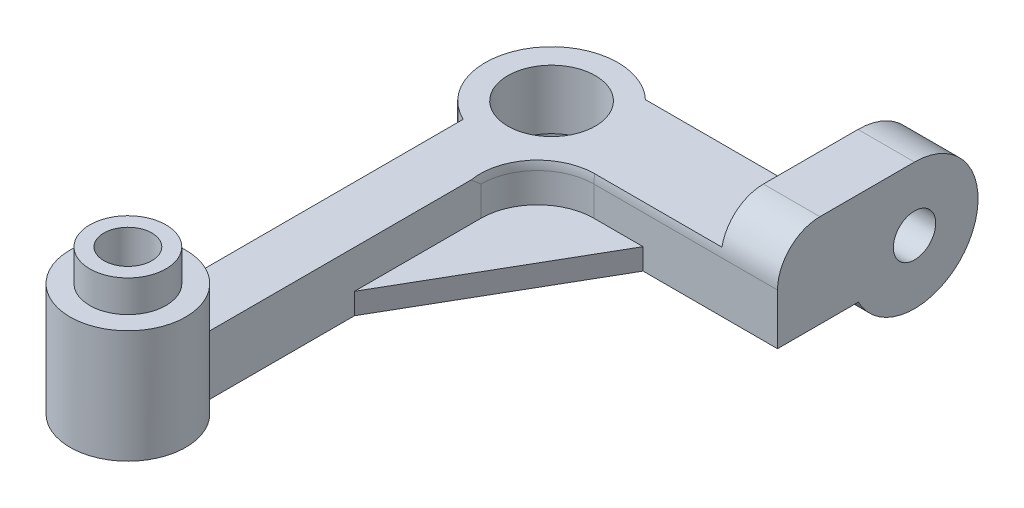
SolidWorks part; units mm, degrees
ref_plane "Plan de face" through (0, 0, 0) normal (0, 0, 1) x (1, 0, 0)
ref_plane "Plan de dessus" through (0, 0, 0) normal (0, 1, 0) x (1, 0, 0)
ref_plane "Plan de droite" through (0, 0, 0) normal (1, 0, 0) x (0, 0, -1)
sketch "Esquisse1" plane through (0, 0, 0) normal (0, 1, 0) x (1, 0, 0)
  line L0 (-13.0712, 0) -> (32.4078, 0) construction
  line L1 (0, 16.033) -> (0, -39.8697) construction
  line L2 (32.4078, 3.4) -> (-6.5829, 3.4) construction
  line L3 (40.421, -3) -> (-13.0712, -3) construction
  line L4 (-2, 23.3976) -> (-2, -39.8697) construction
  line L5 (2, 23.3976) -> (2, -39.8697) construction
  line L6 (15, 23.3976) -> (15, -6.1419) construction
  line L7 (-13.0712, -30) -> (6.0051, -30) construction
  line L8 (15, -3) -> (6, -3)
  line L9 (2, -26.4209) -> (2, -7)
  line L10 (-2, -26.4209) -> (-2, -4.2532)
  line L11 (3.245, 3.4) -> (15, 3.4)
  line L12 (15, 3.4) -> (15, -3)
  circle A0 centre (0, 0) radius 3.1
  arc A1 (2, -7) -> (6, -3) centre (6, -7) cw
  arc A2 (-2, -26.4209) -> (2, -26.4209) centre (0, -30) ccw
  circle A3 centre (0, -30) radius 1.7
  arc A5 (3.245, 3.4) -> (-2, -4.2532) centre (0, 0) ccw
  point P27 (2, -3)
  dimension "D5" = 13
  dimension "D7" = 4
  dimension "D2" = 3.4
  dimension "D1" = 3
  dimension "D3" = 2
  dimension "D4" = 4
  dimension "D6" = 30
extrude "Boss.-Extru.1" add sketch "Esquisse1" along normal blind 4.2
sketch "Esquisse2" plane through (0, 4.2, 0) normal (0, 1, 0) x (1, 0, 0)
  circle A0 centre (0, -30) radius 1.7
  circle A1 centre (0, -30) radius 4.1
extrude "Boss.-Extru.2" add sketch "Esquisse2" along normal blind 3.8
sketch "Esquisse3" plane through (0, 8, 0) normal (0, 1, 0) x (1, 0, 0)
  circle A0 centre (0, -30) radius 1.7
  circle A1 centre (0, -30) radius 2.7
extrude "Boss.-Extru.3" add sketch "Esquisse3" along normal blind 2.25
sketch "Esquisse4" plane through (0, 0, 0) normal (0, -1, 0) x (1, 0, 0)
  line L0 (-0.1464, 19.6708) -> (10.6965, 0.8904) construction
  line L1 (2, 36.0452) -> (2, 3.2) construction
  line L2 (21.2519, 3) -> (0, 3) construction
  line L3 (2, 15.9532) -> (9.4785, 3)
  line L4 (9.4785, 3) -> (2, 3)
  line L5 (2, 3) -> (2, 15.9532)
  line L8 (6, 3) -> (15, 3) construction
  dimension "D1" = 30
extrude "Boss.-Extru.4" add sketch "Esquisse4" against normal blind 1.5
sketch "Esquisse5" plane through (0, 0, 0) normal (0, -1, 0) x (1, 0, 0)
  circle A0 centre (0, 0) radius 3.2
  circle A1 centre (0, 0) radius 4.7
extrude "Boss.-Extru.5" add sketch "Esquisse5" along normal blind 3
sketch "Esquisse6" plane through (15, 0, 0) normal (1, 0, 0) x (0, 0, -1)
  line L0 (0, -4.1322) -> (0, 15.904) construction
  line L1 (10.0748, 4.2) -> (-2.3316, 4.2) construction
  line L2 (4.7, 4.2) -> (-4.2532, 4.2) construction
  line L3 (3.4, 4.2) -> (3.4, 0) construction
  line L4 (3.4, -2.0322) -> (3.4, 8.3156) construction
  line L5 (-3, 0) -> (2.7201, 0)
  line L6 (-3, 0) -> (-3, 6.6)
  line L7 (6.7, -2.0322) -> (6.7, 5.4013) construction
  line L8 (6.7, 6.6) -> (-3, 6.6)
  line L9 (13.7324, 2.1) -> (2.1158, 2.1) construction
  circle A2 centre (6.7, 2.1) radius 1.5
  arc A3 (2.7201, 0) -> (6.7, 6.6) centre (6.7, 2.1) ccw
  dimension "D2" = 3.3
  dimension "D3" = 2.1
extrude "Boss.-Extru.6" add sketch "Esquisse6" along normal blind 4
sketch "Esquisse7" plane through (15, 0, 0) normal (-1, 0, 0) x (0, 0, 1)
  circle A0 centre (-6.7, 2.1) radius 3.3
extrude "Enlèv. mat.-Extru.1" cut sketch "Esquisse7" against normal blind 1
sketch "Esquisse8" plane through (15, 0, 0) normal (-1, 0, 0) x (0, 0, 1)
  line L0 (-3.4, 2.1) -> (-3.4, 3.7014)
  line L1 (5.3052, 4.3115) -> (-11.5581, 4.3115) construction
  line L2 (-10, 10.9144) -> (-10, -0.9617) construction
  line L3 (9.4469, 4.6) -> (-2.1757, 4.6) construction
  line L5 (-10, 2.1) -> (-10, 4.3115)
  line L6 (-10, 4.3115) -> (-10.6191, 4.3115)
  line L7 (-3.4, 3.7014) -> (-2.4946, 3.7014)
  arc A0 (-10.6191, 4.3115) -> (-2.4946, 3.7014) centre (-6.7, 2.1) ccw
  arc A1 (-10, 2.1) -> (-3.4, 2.1) centre (-6.7, 2.1) ccw
extrude "Boss.-Extru.7" add sketch "Esquisse8" along normal blind 3
fillet "Congé1" radius 2 1 edges at (12, 4.3115, -10.3095)
fillet "Congé2" radius 3 1 edges at (17, 6.6, 3)
